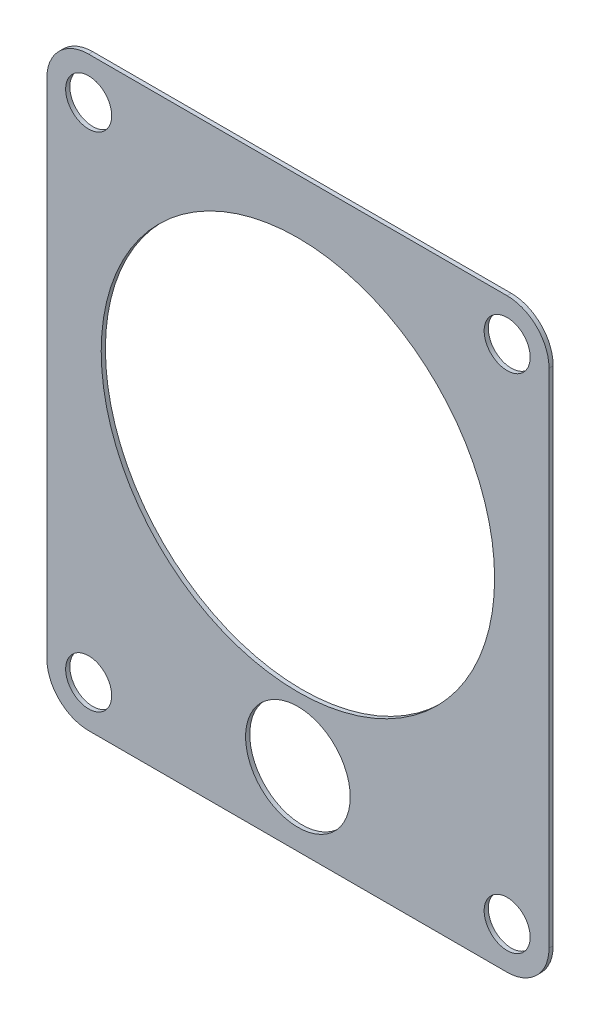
SolidWorks part; units mm, degrees
ref_plane "Face" through (0, 0, 0) normal (0, 0, 1) x (1, 0, 0)
ref_plane "Dessus" through (0, 0, 0) normal (0, 1, 0) x (1, 0, 0)
ref_plane "Droite" through (0, 0, 0) normal (1, 0, 0) x (0, 0, -1)
sketch "Esquisse1" plane through (0, 0, 0) normal (0, 0, 1) x (1, 0, 0)
  line L1 (10, 0) -> (110, 0)
  line L2 (0, 10) -> (0, 130)
  line L3 (10, 140) -> (110, 140)
  line L4 (120, 10) -> (120, 130)
  circle A0 centre (60, 80) radius 47
  circle A1 centre (60, 17.5) radius 12.5
  circle A2 centre (10, 130) radius 5.5
  circle A3 centre (110, 130) radius 5.5
  circle A4 centre (10, 10) radius 5.5
  circle A5 centre (110, 10) radius 5.5
  arc A6 (10, 140) -> (0, 130) centre (10, 130) ccw
  arc A7 (120, 130) -> (110, 140) centre (110, 130) ccw
  arc A8 (120, 10) -> (110, 0) centre (110, 10) cw
  arc A9 (0, 10) -> (10, 0) centre (10, 10) ccw
  point P19 (0, 140)
  point P24 (120, 0)
  point P27 (0, 0)
  dimension "D3" = 94
  dimension "D6" = 25
  dimension "D9" = 11
  dimension "D10" = 11
  dimension "D11" = 11
  dimension "D12" = 11
  dimension "D21" = 10
  dimension "D1" = 140
  dimension "D2" = 120
  dimension "D4" = 60
  dimension "D5" = 60
  dimension "D7" = 60
  dimension "D8" = 122.5
  dimension "D13" = 10
  dimension "D14" = 10
  dimension "D15" = 10
  dimension "D16" = 10
  dimension "D17" = 10
  dimension "D18" = 10
  dimension "D19" = 10
  dimension "D20" = 10
extrude "Base-Extrusion" add sketch "Esquisse1" along normal blind 1
